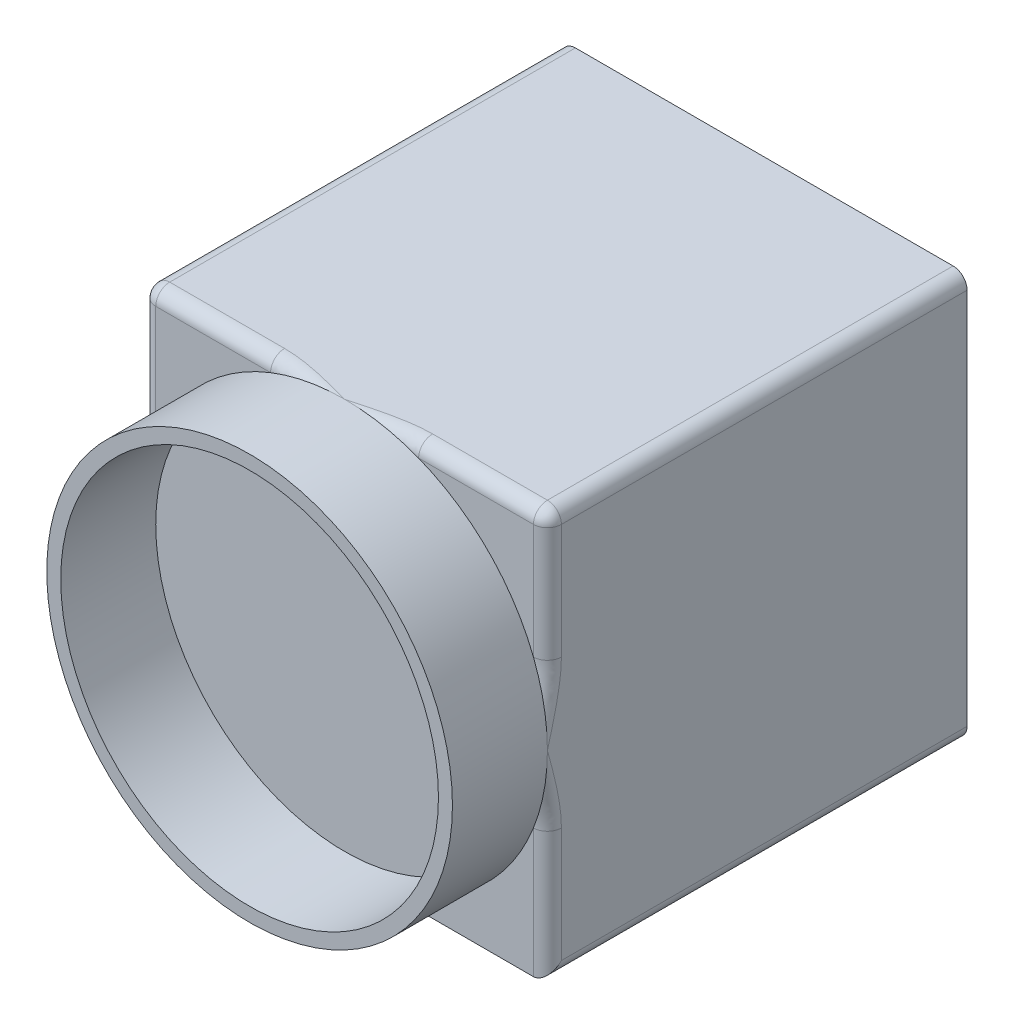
SolidWorks part; units mm, degrees
ref_plane "Front Plane" through (0, 0, 0) normal (0, 0, 1) x (1, 0, 0)
ref_plane "Top Plane" through (0, 0, 0) normal (0, 1, 0) x (1, 0, 0)
ref_plane "Right Plane" through (0, 0, 0) normal (1, 0, 0) x (0, 0, -1)
sketch "Sketch2" plane through (0, 0, 0) normal (0, 0, 1) x (1, 0, 0)
  line L0 (-14.5, 14.5) -> (14.5, -14.5) construction
  line L1 (-14.5, -14.5) -> (14.5, -14.5)
  line L2 (-14.5, -14.5) -> (-14.5, 14.5)
  line L3 (-14.5, 14.5) -> (14.5, 14.5)
  line L4 (14.5, -14.5) -> (14.5, 14.5)
  line L5 (14.5, 14.5) -> (-14.5, -14.5) construction
  point P4 (0, 0)
  dimension "D1" = 29
  dimension "D2" = 29
extrude "Boss-Extrude1" add sketch "Sketch2" against normal blind 30
sketch "Sketch4" plane through (0, 0, 0) normal (0, 0, 1) x (1, 0, 0)
  line L0 (-14.5, 14.5) -> (-14.5, -14.5) construction
  circle A0 centre (0, 0) radius 14.5
  circle A1 centre (0, 0) radius 13.5
  dimension "D1" = 1
extrude "Boss-Extrude2" add sketch "Sketch4" along normal blind 6.79
hole_wizard "M3 Clearance Hole1" positions "Sketch6" profile "Sketch7" hole size "M3" standard "ANSI Metric"
sketch "Sketch6" plane through (0, -14.5, 0) normal (0, -1, 0) x (-1, 0, 0)
  line L0 (0, 0) -> (-14.5, 0) construction
  line L1 (0, 31.1259) -> (0, -9.2824) construction
  point P1 (-10, 3)
  point P3 (10, 3)
  dimension "D1" = 3
  dimension "D2" = 20
  dimension "D3" = 10
sketch "Sketch7" plane through (10, -14.5, -3) normal (1, 0, 0) x (0, 0, -1)
  line L0 (0, 0) -> (0, 3.7614)
  line L1 (0, 3.7614) -> (1.6, 2.8)
  line L2 (1.6, 2.8) -> (1.6, 0)
  line L5 (1.6, 0) -> (0, 0)
  line L10 (0, 3.7614) -> (-1.6, 2.8) construction
  line L11 (0, -6.35) -> (0, 107.95) construction
  dimension "Hole Dia." = 3.2
  dimension "Hole Depth" = 2.8
  dimension "Drill Angle" = 118
hole_wizard "M3 Clearance Hole2" positions "Sketch8" profile "Sketch9" hole size "M3" standard "ANSI Metric"
sketch "Sketch8" plane through (0, -14.5, 0) normal (0, -1, 0) x (-1, 0, 0)
  point P0 (0, 26.7)
  dimension "D1" = 23.7
sketch "Sketch9" plane through (0, -14.5, -26.7) normal (1, 0, 0) x (0, 0, -1)
  line L0 (0, 0) -> (0, 3.4614)
  line L1 (0, 3.4614) -> (1.6, 2.5)
  line L2 (1.6, 2.5) -> (1.6, 0)
  line L5 (1.6, 0) -> (0, 0)
  line L10 (0, 3.4614) -> (-1.6, 2.5) construction
  line L11 (0, -6.35) -> (0, 107.95) construction
  dimension "Hole Dia." = 3.2
  dimension "Hole Depth" = 2.5
  dimension "Drill Angle" = 118
fillet "Fillet1" radius 1 10 edges at (-7.25, 14.5, 0) (-14.5, -7.25, 0) (14.5, -7.25, 0) (7.25, 14.5, 0) (-14.5, 7.25, 0) (14.5, 7.25, 0) (-14.5, -14.5, -15) (14.5, -14.5, -15) (14.5, 14.5, -15) (-14.5, 14.5, -15)
